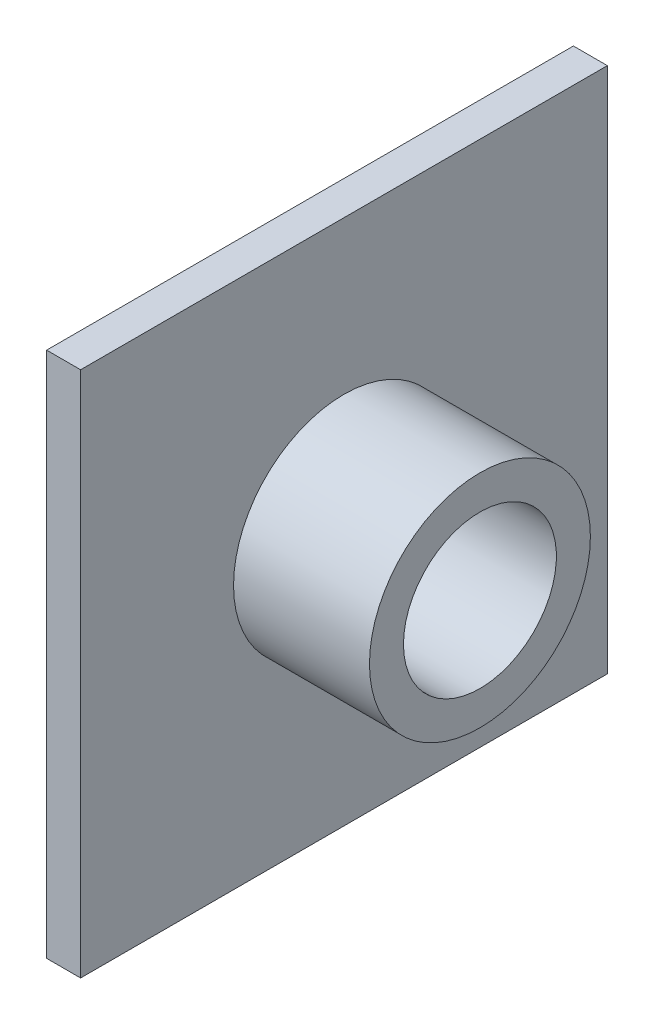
SolidWorks part; units mm, degrees
ref_plane "Front Plane" through (0, 0, 0) normal (0, 0, 1) x (1, 0, 0)
ref_plane "Top Plane" through (0, 0, 0) normal (0, 1, 0) x (1, 0, 0)
ref_plane "Right Plane" through (0, 0, 0) normal (1, 0, 0) x (0, 0, -1)
sketch "Esquisse2" plane through (0, 0, 0) normal (1, 0, 0) x (0, 0, -1)
  line L1 (-31, 31) -> (31, 31)
  line L2 (-31, 31) -> (-31, -31)
  line L3 (-31, -31) -> (31, -31)
  line L4 (31, 31) -> (31, -31)
  line L5 (-31, 31) -> (31, -31) construction
  line L6 (-31, -31) -> (31, 31) construction
  point P0 (0, 0)
  dimension "D1" = 62
extrude "Boss.-Extru.1" add sketch "Esquisse2" along normal blind 4 contours L1 L4 L3 L2
sketch "Esquisse3" plane through (0, 0, 0) normal (-1, 0, 0) x (0, 0, 1)
  circle A0 centre (0, 0) radius 13
  dimension "D1" = 26
extrude "Boss.-Extru.2" add sketch "Esquisse3" against normal blind 20
sketch "Esquisse4" plane through (0, 0, 0) normal (-1, 0, 0) x (0, 0, 1)
  circle A0 centre (0, 0) radius 9
  dimension "D1" = 18
extrude "Enlèv. mat.-Extru.1" cut sketch "Esquisse4" against normal through all
